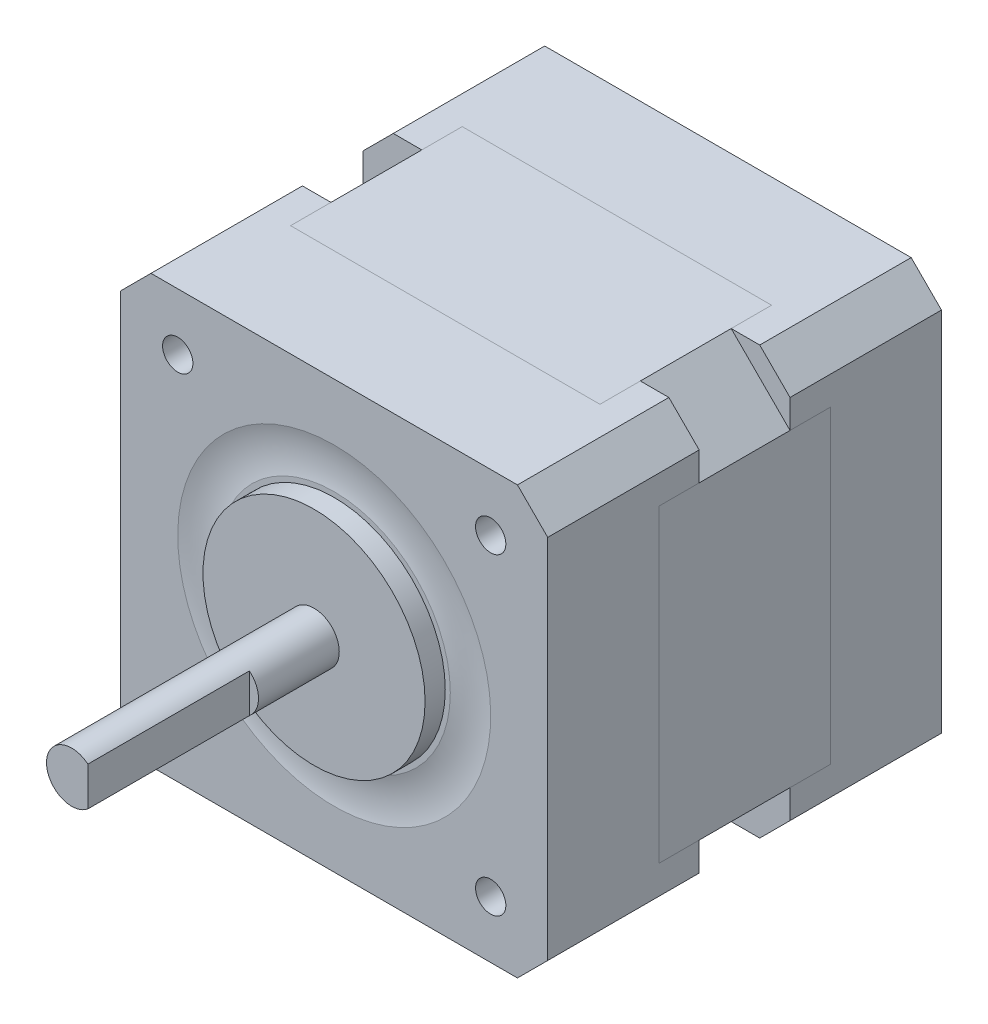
SolidWorks part; units mm, degrees
ref_plane "Front Plane" through (0, 0, 0) normal (0, 0, 1) x (1, 0, 0)
ref_plane "Top Plane" through (0, 0, 0) normal (0, 1, 0) x (1, 0, 0)
ref_plane "Right Plane" through (0, 0, 0) normal (1, 0, 0) x (0, 0, -1)
sketch "Sketch1" plane through (0, 0, 0) normal (0, 0, 1) x (1, 0, 0)
  line L0 (-21.15, 18.15) -> (-18.15, 21.15)
  line L1 (-18.15, 21.15) -> (18.15, 21.15)
  line L2 (-21.15, 18.15) -> (-21.15, -18.15)
  line L3 (-18.15, -21.15) -> (18.15, -21.15)
  line L4 (21.15, 18.15) -> (21.15, -18.15)
  line L5 (-21.15, 21.15) -> (21.15, -21.15) construction
  line L6 (-21.15, -21.15) -> (21.15, 21.15) construction
  line L7 (18.15, 21.15) -> (21.15, 18.15)
  line L8 (18.15, -21.15) -> (21.15, -18.15)
  line L9 (-21.15, -18.15) -> (-18.15, -21.15)
  point P0 (0, 0)
  dimension "D1" = 42.3
  dimension "D2" = 42.3
extrude "Boss-Extrude1" add sketch "Sketch1" along normal blind 15
sketch "Sketch2" plane through (0, 0, 15) normal (0, 0, 1) x (1, 0, 0)
  line L0 (-21.15, 15.3216) -> (-15.3216, 21.15)
  line L1 (-21.15, 18.15) -> (-21.15, -18.15) construction
  line L2 (18.15, 21.15) -> (-18.15, 21.15) construction
  line L3 (-18.15, 21.15) -> (-21.15, 18.15) construction
  line L4 (15.3216, 21.15) -> (21.15, 15.3216)
  line L5 (21.15, -15.3216) -> (15.3216, -21.15)
  line L6 (-15.3216, -21.15) -> (-21.15, -15.3216)
  line L7 (-21.15, 15.3216) -> (-21.15, -15.3216)
  line L8 (-15.3216, 21.15) -> (15.3216, 21.15)
  line L9 (21.15, 15.3216) -> (21.15, -15.3216)
  line L10 (15.3216, -21.15) -> (-15.3216, -21.15)
  point P17 (0, 0)
  dimension "D1" = 2
  dimension "D2" = 4
extrude "Cut-Extrude1" cut sketch "Sketch2" against normal blind 4
sketch "Sketch3" plane through (0, 0, 11) normal (0, 0, 1) x (1, 0, 0)
  line L8 (-21.15, -15.3216) -> (-15.3216, -21.15)
  line L9 (-15.3216, -21.15) -> (15.3216, -21.15)
  line L10 (15.3216, -21.15) -> (21.15, -15.3216)
  line L11 (21.15, -15.3216) -> (21.15, 15.3216)
  line L12 (21.15, 15.3216) -> (15.3216, 21.15)
  line L13 (15.3216, 21.15) -> (-15.3216, 21.15)
  line L14 (-15.3216, 21.15) -> (-21.15, 15.3216)
  line L15 (-21.15, 15.3216) -> (-21.15, -15.3216)
  line L16 (-21.15, -15.3216) -> (-15.3216, -21.15)
  line L17 (-15.3216, -21.15) -> (15.3216, -21.15)
  line L18 (15.3216, -21.15) -> (21.15, -15.3216)
  line L19 (21.15, -15.3216) -> (21.15, 15.3216)
  line L20 (21.15, 15.3216) -> (15.3216, 21.15)
  line L21 (15.3216, 21.15) -> (-15.3216, 21.15)
  line L22 (-15.3216, 21.15) -> (-21.15, 15.3216)
  line L23 (-21.15, 15.3216) -> (-21.15, -15.3216)
  dimension "D1" = 0
ref_plane "Plane2" through (0, 0, 39) normal (0, 0, -1) x (-1, 0, 0)
sketch "Sketch8" plane through (0, 0, 39) normal (0, 0, -1) x (-1, 0, 0)
  line L8 (21.15, 18.15) -> (18.15, 21.15)
  line L9 (18.15, 21.15) -> (-18.15, 21.15)
  line L10 (-18.15, 21.15) -> (-21.15, 18.15)
  line L11 (-21.15, 18.15) -> (-21.15, -18.15)
  line L12 (-21.15, -18.15) -> (-18.15, -21.15)
  line L13 (-18.15, -21.15) -> (18.15, -21.15)
  line L14 (18.15, -21.15) -> (21.15, -18.15)
  line L15 (21.15, -18.15) -> (21.15, 18.15)
  line L16 (21.15, 18.15) -> (18.15, 21.15)
  line L17 (18.15, 21.15) -> (-18.15, 21.15)
  line L18 (-18.15, 21.15) -> (-21.15, 18.15)
  line L19 (-21.15, 18.15) -> (-21.15, -18.15)
  line L20 (-21.15, -18.15) -> (-18.15, -21.15)
  line L21 (-18.15, -21.15) -> (18.15, -21.15)
  line L22 (18.15, -21.15) -> (21.15, -18.15)
  line L23 (21.15, -18.15) -> (21.15, 18.15)
  dimension "D1" = 0
extrude "Boss-Extrude7" add sketch "Sketch8" along normal blind 15 separate body
sketch "Sketch9" plane through (0, 0, 24) normal (0, 0, -1) x (-1, 0, 0)
  line L8 (15.3216, -21.15) -> (21.15, -15.3216)
  line L9 (-15.3216, -21.15) -> (15.3216, -21.15)
  line L10 (-21.15, -15.3216) -> (-15.3216, -21.15)
  line L11 (-21.15, 15.3216) -> (-21.15, -15.3216)
  line L12 (-15.3216, 21.15) -> (-21.15, 15.3216)
  line L13 (15.3216, 21.15) -> (-15.3216, 21.15)
  line L14 (21.15, 15.3216) -> (15.3216, 21.15)
  line L15 (21.15, -15.3216) -> (21.15, 15.3216)
  line L16 (15.3216, -21.15) -> (21.15, -15.3216)
  line L17 (-15.3216, -21.15) -> (15.3216, -21.15)
  line L18 (-21.15, -15.3216) -> (-15.3216, -21.15)
  line L19 (-21.15, 15.3216) -> (-21.15, -15.3216)
  line L20 (-15.3216, 21.15) -> (-21.15, 15.3216)
  line L21 (15.3216, 21.15) -> (-15.3216, 21.15)
  line L22 (21.15, 15.3216) -> (15.3216, 21.15)
  line L23 (21.15, -15.3216) -> (21.15, 15.3216)
  dimension "D1" = 0
extrude "Cut-Extrude2" cut sketch "Sketch9" against normal blind 4
extrude "Boss-Extrude8" add sketch "Sketch3" along normal blind 17 separate body
sketch "Sketch10" plane through (0, 0, 39) normal (0, 0, 1) x (1, 0, 0)
  circle A0 centre (-15.5, 15.5) radius 1.5
  circle A1 centre (15.5, 15.5) radius 1.5
  circle A2 centre (15.5, -15.5) radius 1.5
  circle A3 centre (-15.5, -15.5) radius 1.5
  dimension "D5" = 3
  dimension "D1" = 31
  dimension "D2" = 15.5
  dimension "D3" = 31
  dimension "D4" = 15.5
extrude "Cut-Extrude3" cut sketch "Sketch10" against normal blind 5.5
sketch "Sketch11" plane through (0, 0, 39) normal (0, 0, 1) x (1, 0, 0)
  circle A0 centre (0, 0) radius 11
  dimension "D1" = 22
extrude "Boss-Extrude9" add sketch "Sketch11" along normal blind 2 separate body
sketch "Sketch12" plane through (0, 0, 41) normal (0, 0, 1) x (1, 0, 0)
  circle A0 centre (0, 0) radius 2.5
  dimension "D1" = 5
extrude "Boss-Extrude10" add sketch "Sketch12" along normal blind 24 separate body
sketch "Sketch13" plane through (0, 0, 65) normal (0, 0, 1) x (1, 0, 0)
  line L0 (1.6, 1.9209) -> (1.6, -1.9209)
  circle A1 centre (0, 0) radius 2.5
  arc A2 (1.6, -1.9209) -> (1.6, 1.9209) centre (0, 0) ccw
  dimension "D2" = 1.6
  dimension "D1" = 0
extrude "Cut-Extrude4" cut sketch "Sketch13" against normal blind 16
sketch "Sketch14" plane through (0, 0, 0) normal (0, 0, -1) x (-1, 0, 0)
  circle A1 centre (15.5, -15.5) radius 1.5
  circle A2 centre (15.5, -15.5) radius 1.5
  circle A3 centre (-15.5, -15.5) radius 1.5
  circle A4 centre (-15.5, -15.5) radius 1.5
  circle A5 centre (-15.5, 15.5) radius 1.5
  circle A6 centre (-15.5, 15.5) radius 1.5
  circle A7 centre (15.5, 15.5) radius 1.5
  circle A8 centre (15.5, 15.5) radius 1.5
  dimension "D1" = 0
  dimension "D2" = 0
  dimension "D3" = 0
  dimension "D4" = 0
extrude "Cut-Extrude5" cut sketch "Sketch14" against normal blind 5.5
sketch "Sketch15" plane through (0, 0, 0) normal (1, 0, 0) x (0, 0, -1)
  line L0 (-39, 0) -> (-49, 0) construction
  line L1 (-39, 18.15) -> (-39, -18.15) construction
  line L2 (-49, 1.9209) -> (-49, -1.9209) construction
  line L3 (-39, 11.5) -> (-39, 15.5)
  line L4 (-39, 11) -> (-41, 11) construction
  arc A0 (-39, 15.5) -> (-39, 11.5) centre (-46.746, 13.5) cw
  dimension "D3" = 8
  dimension "D1" = 4
  dimension "D2" = 0.5
revolve "Cut-Revolve1" cut sketch "Sketch15" angle 360 about L0
sketch "Sketch16" plane through (0, 0, 0) normal (0, 0, -1) x (-1, 0, 0)
  circle A0 centre (0, 0) radius 2.5 construction
  circle A1 centre (0, 0) radius 4
  dimension "D1" = 5
  dimension "D2" = 8
extrude "Cut-Extrude6" cut sketch "Sketch16" against normal blind 2
sketch "Sketch17" plane through (0, 0, 2) normal (0, 0, -1) x (-1, 0, 0)
  circle A0 centre (0, 0) radius 2.5
  dimension "D1" = 5
extrude "Boss-Extrude11" add sketch "Sketch17" along normal blind 1 separate body
sketch "Sketch18" plane through (0, 0, 0) normal (0, 0, -1) x (-1, 0, 0)
  circle A0 centre (15.5, -15.5) radius 2.75
  circle A1 centre (-15.5, -15.5) radius 2.75
  circle A2 centre (-15.5, 15.5) radius 2.75
  circle A3 centre (15.5, 15.5) radius 2.75
  point P12 (0, 0)
  dimension "D1" = 5.5
  dimension "D2" = 4
extrude "Cut-Extrude7" cut sketch "Sketch18" against normal blind 1
